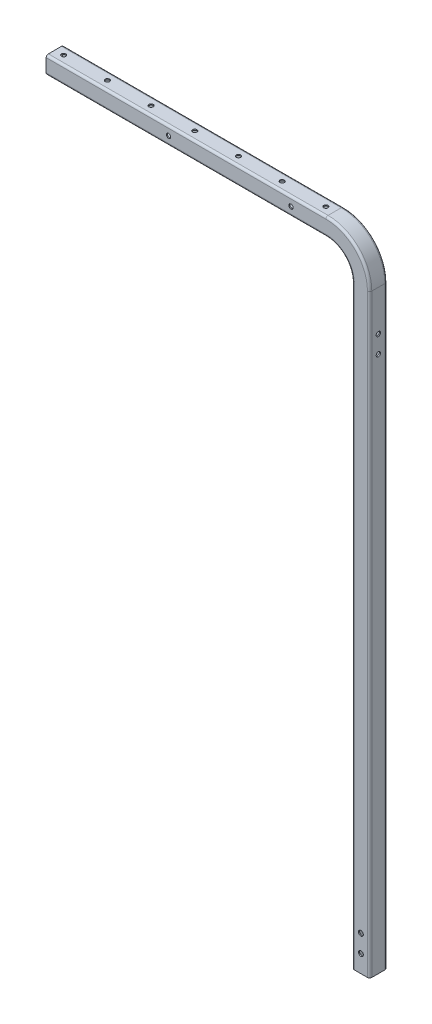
SolidWorks part; units mm, degrees
ref_plane "Front" through (0, 0, 0) normal (0, 0, 1) x (1, 0, 0)
ref_plane "Top" through (0, 0, 0) normal (0, 1, 0) x (1, 0, 0)
ref_plane "Right" through (0, 0, 0) normal (1, 0, 0) x (0, 0, -1)
sketch "Sketch1" plane through (0, 0, 0) normal (0, 0, 1) x (1, 0, 0)
  line L0 (0, 0) -> (406.4, 0)
  line L1 (457.2, -50.8) -> (457.2, -914.4)
  arc A0 (457.2, -50.8) -> (406.4, 0) centre (406.4, -50.8) ccw
  dimension "D1" = 50.8
  dimension "D2" = 457.2
  dimension "D3" = 914.4
sketch "Sketch2"
  line L0 (-12.7, 12.7) -> (12.7, 12.7)
  line L1 (-12.7, 12.7) -> (-12.7, -12.7)
  line L2 (12.7, -12.7) -> (-12.7, -12.7)
  line L3 (12.7, -12.7) -> (12.7, 12.7)
  line L4 (12.7, 12.7) -> (-12.7, -12.7) construction
  dimension "square" = 25.4
sweep "Base-Sweep" add profiles "Sketch2" path "Sketch1"
fillet "Fillet1" radius 3.175 12 edges at (451.3013, -5.8987, 12.7) (451.3013, -5.8987, -12.7) (433.3408, -23.8592, -12.7) (433.3408, -23.8592, 12.7) (469.9, -482.6, 12.7) (469.9, -482.6, -12.7) (444.5, -482.6, -12.7) (444.5, -482.6, 12.7) (203.2, 12.7, 12.7) (203.2, 12.7, -12.7) (203.2, -12.7, -12.7) (203.2, -12.7, 12.7)
shell "Shell1" thickness 1.5875
sketch "Sketch3" plane through (0, 12.7, 0) normal (0, 1, 0) x (-1, 0, 0)
  line L0 (0, 0) -> (-406.4, 0) construction
  line L1 (0, 9.525) -> (0, -9.525) construction
  circle A0 centre (-12.7, 0) radius 3.175
  dimension "D2" = 6.35
  dimension "D1" = 12.7
extrude "Wood Hole" cut sketch "Sketch3" against normal up to next
pattern_linear "LPattern1" count 7 spacing 63.5 along (1, 0, 0) of "Wood Hole"
sketch "Sketch5" plane through (469.9, 0, 0) normal (1, 0, 0) x (0, 0, -1)
  line L4 (-9.525, 12.7) -> (9.525, 12.7) construction
  line L5 (0, 50) -> (0, -50) construction
  circle A4 centre (0, -109.5375) radius 3.175
  circle A5 centre (0, -134.9375) radius 3.175
  dimension "D1" = 122.2375
  dimension "D3" = 6.35
  dimension "D2" = 25.4
extrude "cont_mtg" cut sketch "Sketch5" against normal through all
hole_wizard "1/4 (0.25) Diameter Hole1" positions "Sketch7" profile "Sketch6" hole size "1/4" standard "Ansi Inch"
sketch "Sketch7" plane through (0, 0, 12.7) normal (0, 0, 1) x (1, 0, 0)
  line L1 (0, 9.525) -> (0, -9.525) construction
  line L2 (0, 0) -> (406.4, 0) construction
  point P0 (177.8, 0)
  point P1 (355.6, 0)
  dimension "D1" = 177.8
  dimension "D2" = 355.6
sketch "Sketch6" plane through (177.8, 0, 12.7) normal (1, 0, 0) x (0, -1, 0)
  line L0 (0, 0) -> (0, 25.4)
  line L1 (0, 25.4) -> (3.175, 25.4)
  line L2 (3.175, 25.4) -> (3.175, 0)
  line L5 (3.175, 0) -> (0, 0)
  line L11 (0, -6.35) -> (0, 107.95) construction
  dimension "Thru Hole Dia." = 6.35
  dimension "Thru Hole Depth" = 25.4
sketch "Sketch8" plane through (0, 0, -12.7) normal (0, 0, -1) x (-1, 0, 0)
  line L1 (-447.675, -914.4) -> (-466.725, -914.4) construction
  line L2 (-457.2, -50.8) -> (-457.2, -914.4) construction
  circle A1 centre (-457.2, -889) radius 3.5719
  dimension "D1" = 7.1437
  dimension "D3" = 25.4
extrude "Cut-Extrude1" cut sketch "Sketch8" against normal through all
pattern_linear "LPattern2" count 2 spacing 25.4 along (0, 1, 0) of "Cut-Extrude1"
